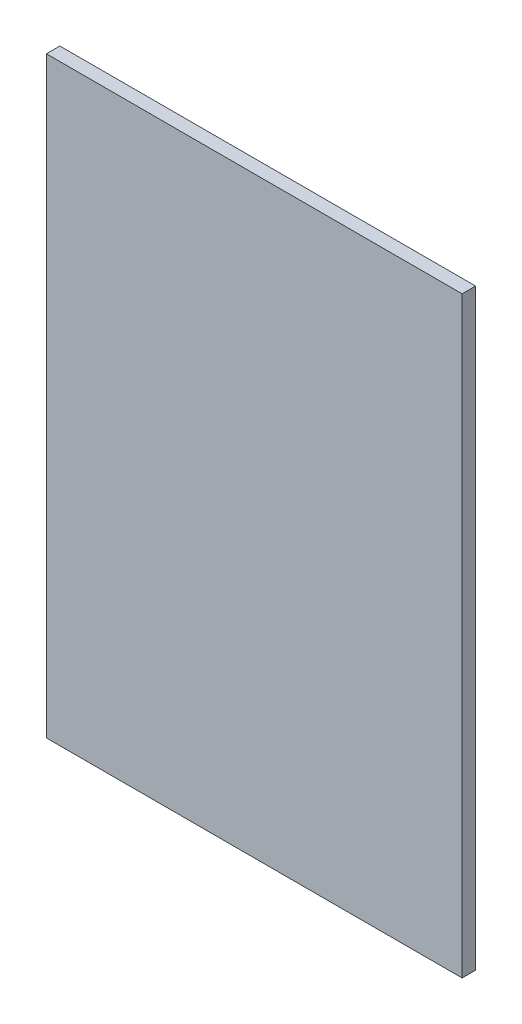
SolidWorks part; units mm, degrees
ref_plane "Alzado" through (0, 0, 0) normal (0, 0, 1) x (1, 0, 0)
ref_plane "Planta" through (0, 0, 0) normal (0, 1, 0) x (1, 0, 0)
ref_plane "Vista lateral" through (0, 0, 0) normal (1, 0, 0) x (0, 0, -1)
sketch "Croquis1" plane through (0, 0, 0) normal (0, 0, 1) x (1, 0, 0)
  line L1 (-323.2926, 227.0879) -> (294.2074, 227.0879)
  line L2 (-323.2926, 227.0879) -> (-323.2926, -652.9121)
  line L3 (-323.2926, -652.9121) -> (294.2074, -652.9121)
  line L4 (294.2074, 227.0879) -> (294.2074, -652.9121)
  dimension "D1" = 617.5
  dimension "D2" = 880
extrude "Saliente-Extruir1" add sketch "Croquis1" along normal blind 20
